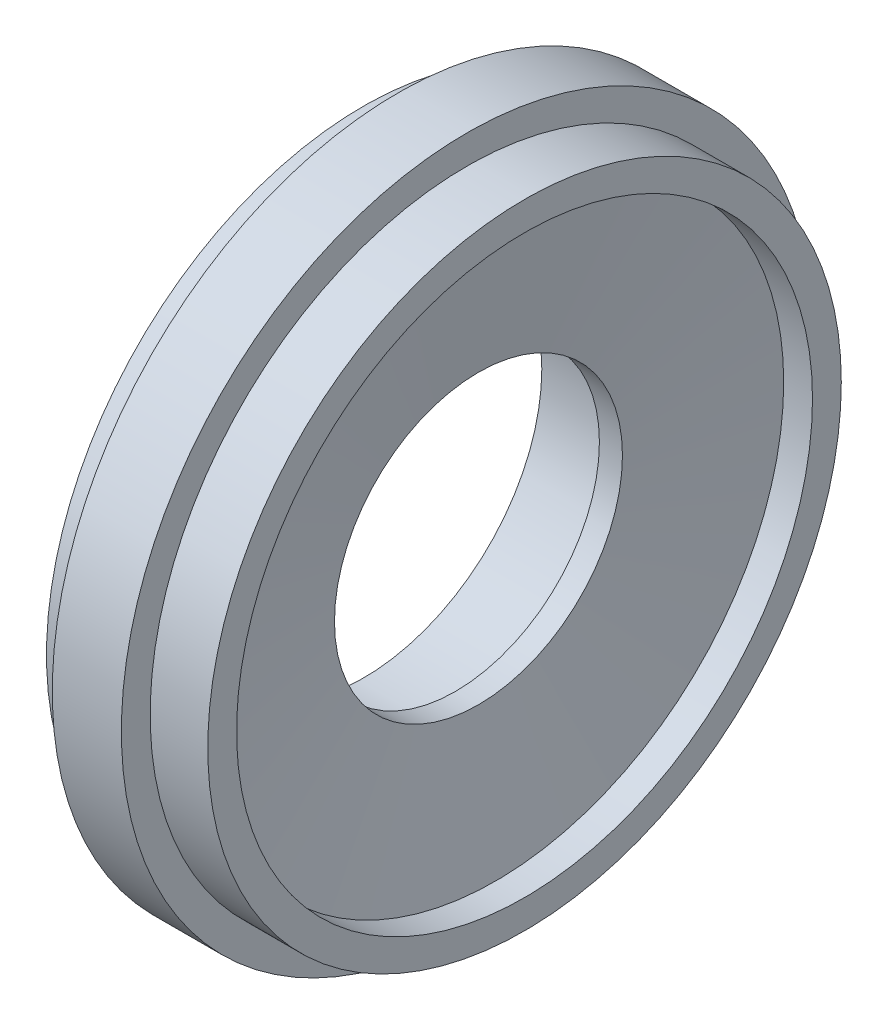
SolidWorks part; units mm, degrees
ref_plane "Спереди" through (0, 0, 0) normal (0, 0, 1) x (1, 0, 0)
ref_plane "Сверху" through (0, 0, 0) normal (0, 1, 0) x (1, 0, 0)
ref_plane "Справа" through (0, 0, 0) normal (1, 0, 0) x (0, 0, -1)
sketch "Sketch1" plane through (0, 0, 0) normal (0, 0, 1) x (1, 0, 0)
  line L0 (56.9262, 0) -> (-20.3088, 0) construction
  line L1 (0, 0) -> (0, 55)
  line L2 (0, 55) -> (6, 55)
  line L3 (6, 55) -> (6, 60)
  line L4 (6, 60) -> (18, 60)
  line L5 (18, 60) -> (18, 55)
  line L6 (18, 55) -> (28, 55)
  line L7 (28, 55) -> (28, 50)
  line L8 (28, 50) -> (23, 50)
  line L9 (23, 50) -> (20, 25)
  line L10 (20, 25) -> (20, 0)
  line L11 (20, 0) -> (0, 0)
  line L12 (0, 31) -> (16, 31)
  line L13 (16, 31) -> (16, 0)
  line L14 (16, 25) -> (20, 25)
  dimension "D1" = 62
  dimension "D2" = 16
  dimension "D3" = 110
  dimension "D4" = 120
  dimension "D5" = 6
  dimension "D6" = 12
  dimension "D7" = 28
  dimension "D8" = 5
  dimension "D9" = 50
  dimension "D10" = 20
  dimension "D11" = 5
revolve "Revolve1" add sketch "Sketch1" angle 360 about L0
